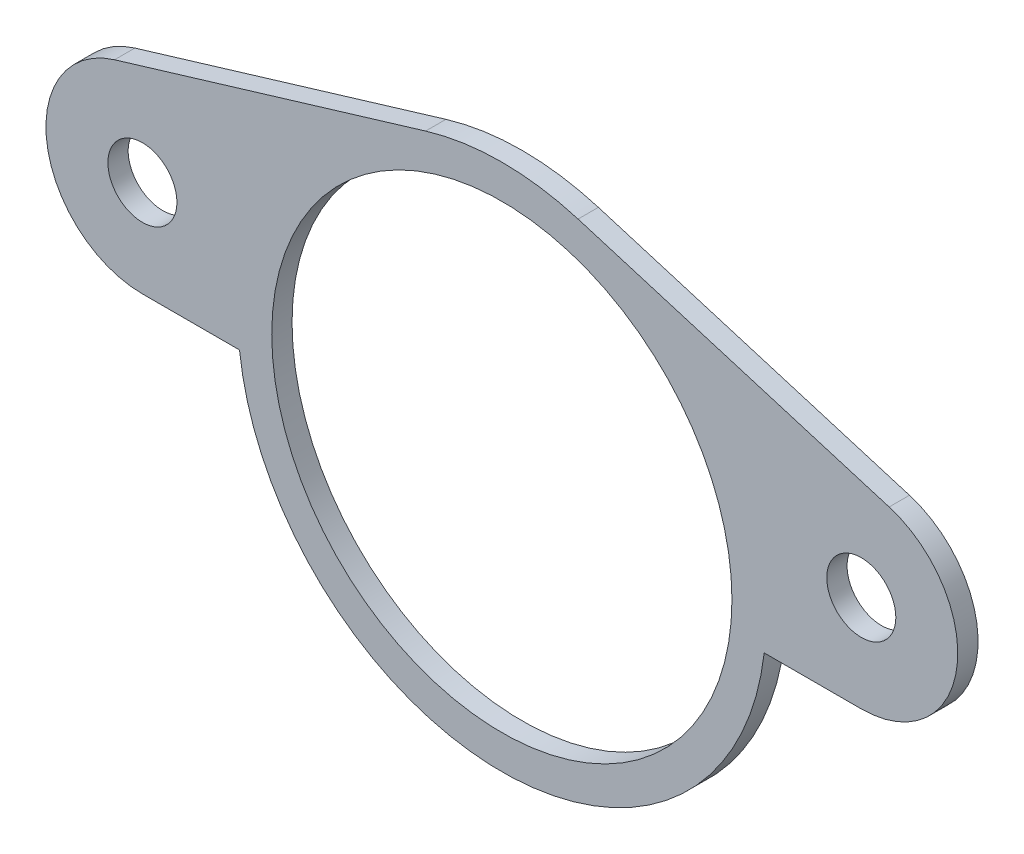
SolidWorks part; units mm, degrees
ref_plane "Front Plane" through (0, 0, 0) normal (0, 0, 1) x (1, 0, 0)
ref_plane "Top Plane" through (0, 0, 0) normal (0, 1, 0) x (1, 0, 0)
ref_plane "Right Plane" through (0, 0, 0) normal (1, 0, 0) x (0, 0, -1)
sketch "Sketch1" plane through (0, 0, 0) normal (0, 0, 1) x (1, 0, 0)
  line L0 (0, 0) -> (0, -25) construction
  line L1 (0, -25) -> (-28.2843, 3.2843) construction
  line L2 (0, -25) -> (-7.2742, -25) construction
  line L3 (12.9166, -1.47) -> (17.6986, -1.47)
  line L4 (-17.6986, 3.28) -> (17.6986, 3.28) construction
  line L5 (-12.9166, -1.47) -> (-17.6986, -1.47)
  line L6 (-19.07, 7.8277) -> (-3.7532, 12.4464)
  line L7 (3.7532, 12.4464) -> (19.07, 7.8277)
  circle A0 centre (0, 0) radius 11.33 construction
  circle A1 centre (0, 0) radius 18 construction
  circle A2 centre (-17.6986, 3.28) radius 1.7
  circle A3 centre (17.6986, 3.28) radius 1.7
  arc A4 (-33.5842, -3.2721) -> (36.2339, -8.0559) centre (0, -25) cw construction
  circle A5 centre (0, 0) radius 13 construction
  arc A6 (-12.7279, -12.2721) -> (9.6253, -9.7897) centre (0, -25) cw construction
  arc A7 (12.9166, -1.47) -> (-12.9166, -1.47) centre (0, 0) cw
  arc A8 (-19.07, 7.8277) -> (-17.6986, -1.47) centre (-17.6986, 3.28) ccw
  arc A9 (-3.7532, 12.4464) -> (3.7532, 12.4464) centre (0, 0) cw
  arc A10 (19.07, 7.8277) -> (17.6986, -1.47) centre (17.6986, 3.28) cw
  circle A11 centre (0, 0) radius 11.33
  dimension "D1" = 22.66
  dimension "D2" = 36
  dimension "D3" = 3.4
  dimension "D5" = 40
  dimension "D7" = 26
  dimension "D8" = 18
  dimension "D4" = 25
  dimension "D6" = 45
  dimension "D9" = 4.75
  dimension "D10" = 3.28
extrude "Boss-Extrude1" add sketch "Sketch1" along normal blind 1
